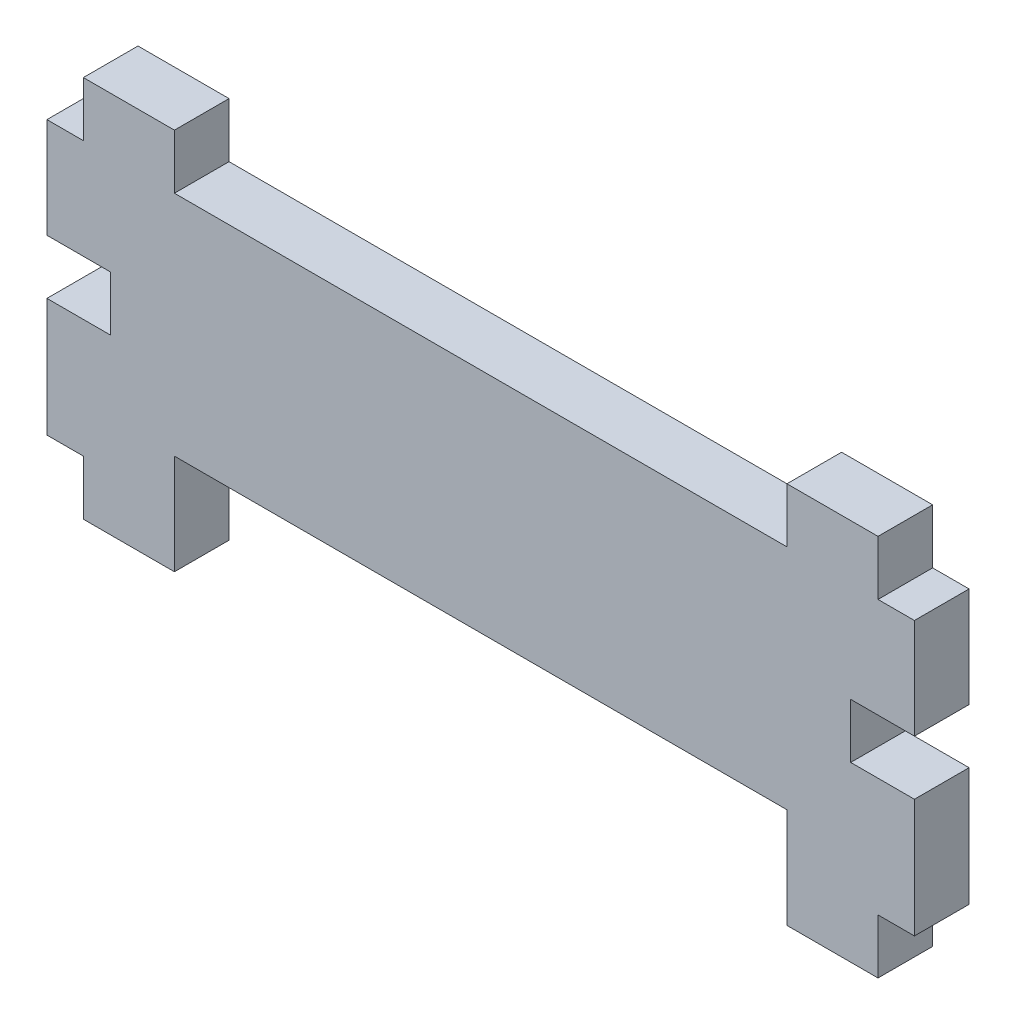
SolidWorks part; units mm, degrees
ref_plane "Alzado" through (0, 0, 0) normal (0, 0, 1) x (1, 0, 0)
ref_plane "Planta" through (0, 0, 0) normal (0, 1, 0) x (1, 0, 0)
ref_plane "Vista lateral" through (0, 0, 0) normal (1, 0, 0) x (0, 0, -1)
sketch "Croquis1" plane through (0, 0, 0) normal (0, 0, 1) x (1, 0, 0)
  line L0 (-10.5787, -2.3141) -> (-12.5787, -2.3141)
  line L1 (-10.5787, -17.3141) -> (-10.5787, -20.3141)
  line L2 (-10.5787, -20.3141) -> (-5.5787, -20.3141)
  line L3 (-5.5787, -20.3141) -> (-5.5787, -17.3141)
  line L4 (-5.5787, -17.3141) -> (-5.5787, -14.8141)
  line L5 (28.0513, -14.8141) -> (-5.5787, -14.8141)
  line L6 (28.0513, -2.3141) -> (28.0513, 0.6859)
  line L7 (33.0513, -2.3141) -> (35.0513, -2.3141)
  line L8 (28.0513, 0.6859) -> (33.0513, 0.6859)
  line L9 (33.0513, 0.6859) -> (33.0513, -2.3141)
  line L10 (-12.5787, -7.8141) -> (-12.5787, -2.3141)
  line L11 (-10.5787, -2.3141) -> (-10.5787, 0.6859)
  line L12 (-10.5787, 0.6859) -> (-5.5787, 0.6859)
  line L13 (35.0513, -17.3141) -> (35.0513, -10.8141)
  line L14 (28.0513, -17.3141) -> (28.0513, -14.8141)
  line L15 (28.0513, -17.3141) -> (28.0513, -20.3141)
  line L16 (-12.5787, -17.3141) -> (-10.5787, -17.3141)
  line L17 (-5.5787, 0.6859) -> (-5.5787, -2.3141)
  line L18 (35.0513, -17.3141) -> (33.0513, -17.3141)
  line L19 (28.0513, -2.3141) -> (-5.5787, -2.3141)
  line L20 (28.0513, -20.3141) -> (33.0513, -20.3141)
  line L21 (33.0513, -20.3141) -> (33.0513, -17.3141)
  line L22 (35.0513, -10.8141) -> (31.5513, -10.8141)
  line L23 (31.5513, -10.8141) -> (31.5513, -7.8141)
  line L24 (31.5513, -7.8141) -> (35.0513, -7.8141)
  line L25 (35.0513, -7.8141) -> (35.0513, -2.3141)
  line L27 (-9.0787, -7.8141) -> (-12.5787, -7.8141)
  line L28 (-9.0787, -10.8141) -> (-9.0787, -7.8141)
  line L29 (-12.5787, -10.8141) -> (-9.0787, -10.8141)
  line L30 (-12.5787, -17.3141) -> (-12.5787, -10.8141)
extrude "Saliente-Extruir1" add sketch "Croquis1" along normal blind 3
